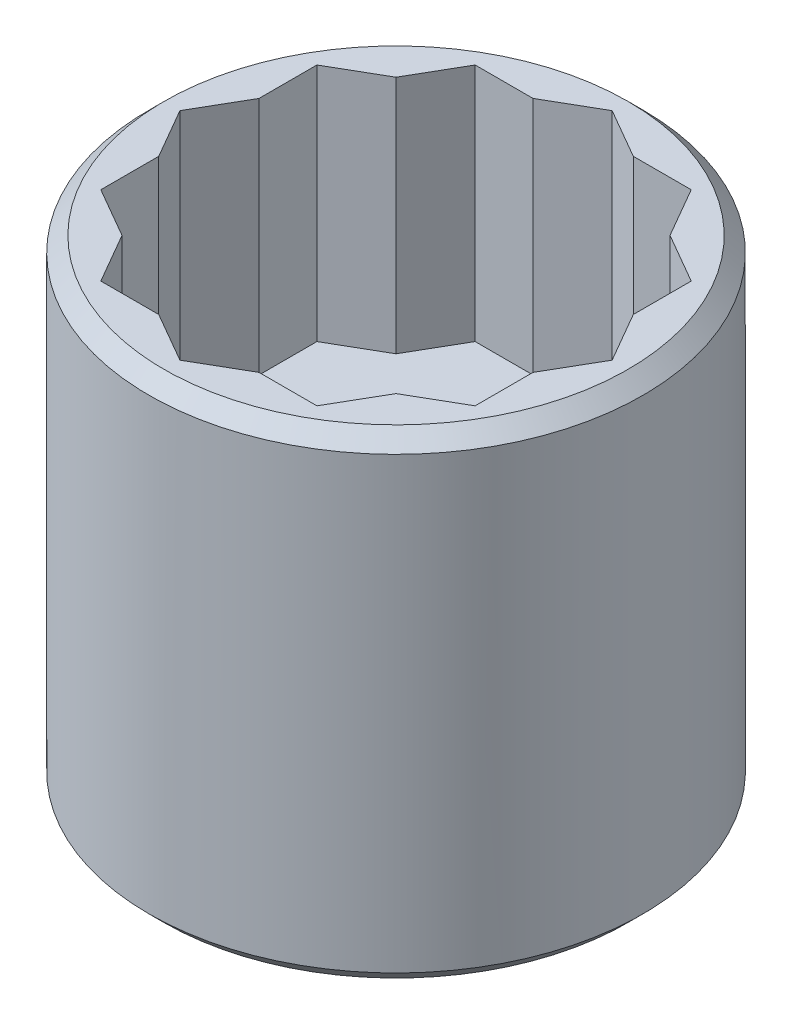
SolidWorks part; units mm, degrees
ref_plane "Front Plane" through (0, 0, 0) normal (0, 0, 1) x (1, 0, 0)
ref_plane "Top Plane" through (0, 0, 0) normal (0, 1, 0) x (1, 0, 0)
ref_plane "Right Plane" through (0, 0, 0) normal (1, 0, 0) x (0, 0, -1)
sketch "Sketch1" plane through (0, 0, 0) normal (0, 1, 0) x (1, 0, 0)
  circle A0 centre (0, 0) radius 13.0969
  dimension "CylinderDiameter" = 26.1937
extrude "Cylinder" add sketch "Sketch1" along normal blind 25.4
sketch "Sketch2" plane through (0, 25.4, 0) normal (0, 1, 0) x (-1, 0, 0)
  line L1 (-11.4568, 0) -> (-5.7284, -9.9219)
  line L2 (-5.7284, -9.9219) -> (5.7284, -9.9219)
  line L3 (5.7284, -9.9219) -> (11.4568, 0)
  line L4 (11.4568, 0) -> (5.7284, 9.9219)
  line L5 (5.7284, 9.9219) -> (-5.7284, 9.9219)
  line L6 (-5.7284, 9.9219) -> (-11.4568, 0)
  circle A0 centre (0, 0) radius 9.9219 construction
  dimension "AcrossFlats" = 19.8438
extrude "6 Point" cut sketch "Sketch2" against normal blind 12.7
sketch "Sketch3" plane through (-3.872, 25.4, 9.385) normal (0, 1, 0) x (-1, 0, 0)
  line L1 (-13.7939, -15.1134) -> (-3.872, -20.8418)
  line L2 (-3.872, -20.8418) -> (6.0499, -15.1134)
  line L3 (6.0499, -15.1134) -> (6.0499, -3.6566)
  line L4 (6.0499, -3.6566) -> (-3.872, 2.0718)
  line L5 (-3.872, 2.0718) -> (-13.7939, -3.6566)
  line L6 (-13.7939, -3.6566) -> (-13.7939, -15.1134)
  line L7 (-3.872, -9.385) -> (-12.4646, -14.3459) construction
  line L9 (-15.3288, -9.385) -> (-9.6004, -19.3069) construction
  circle A0 centre (-3.872, -9.385) radius 9.9219 construction
  circle A1 centre (-3.872, -9.385) radius 13.0969 construction
extrude "12 Point" cut sketch "Sketch3" against normal up to surface (12.7 mm away)
sketch "Sketch4" plane through (0, 0, 0) normal (0, -1, 0) x (1, 0, 0)
  line L0 (-3.175, 3.175) -> (3.175, -3.175) construction
  line L1 (-3.175, 3.175) -> (3.175, 3.175)
  line L2 (-3.175, 3.175) -> (-3.175, -3.175)
  line L3 (-3.175, -3.175) -> (3.175, -3.175)
  line L4 (3.175, 3.175) -> (3.175, -3.175)
  dimension "DriveSquare" = 6.35
extrude "Drive" cut sketch "Sketch4" against normal up to next
chamfer "Chamfer1" distance 0.7937 angle 45 2 edges at (0, 0, 13.0969) (0, 25.4, 13.0969)
equation "\"CylinderDiameter@Sketch1\"= \"AcrossFlats@Sketch2\" + 0.25"
